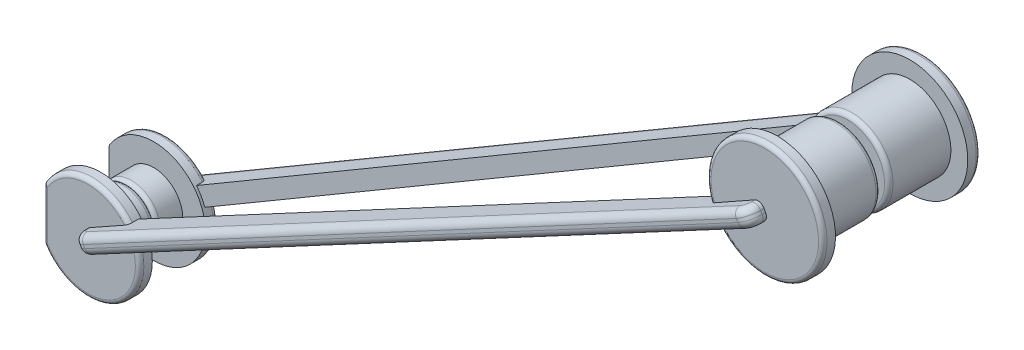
SolidWorks part; units mm, degrees
ref_plane "Front Plane" through (0, 0, 0) normal (0, 0, 1) x (1, 0, 0)
ref_plane "Top Plane" through (0, 0, 0) normal (0, 1, 0) x (1, 0, 0)
ref_plane "Right Plane" through (0, 0, 0) normal (1, 0, 0) x (0, 0, -1)
mirrored part "Support Arm_Mirrored"
other "<Support Arm>-<Fillet1>"
